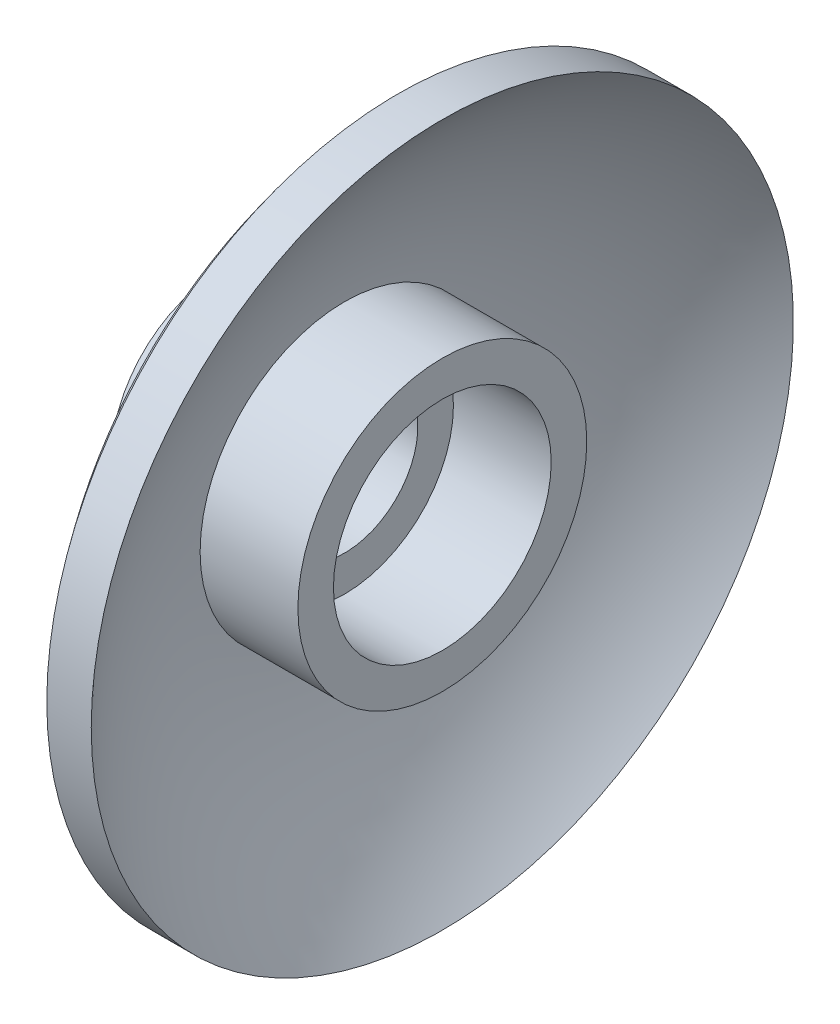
SolidWorks part; units mm, degrees
ref_plane "Vorne" through (0, 0, 0) normal (0, 0, 1) x (1, 0, 0)
ref_plane "Oben" through (0, 0, 0) normal (0, 1, 0) x (1, 0, 0)
ref_plane "Rechts" through (0, 0, 0) normal (1, 0, 0) x (0, 0, -1)
sketch "Skizze1" plane through (0, 0, 0) normal (0, 0, 1) x (1, 0, 0)
  line L0 (0, 0) -> (25.7013, 0) construction
  line L1 (17.0474, 3.25) -> (17.0474, 2.45)
  line L2 (17.0474, 3.25) -> (14.8474, 3.25)
  line L3 (12.0474, 1.65) -> (14.8474, 1.65)
  line L5 (17.0474, 7.9) -> (16.0474, 7.9)
  line L6 (13.9035, 2.45) -> (12.0474, 2.45)
  line L7 (12.0474, 2.45) -> (12.0474, 1.65)
  line L8 (17.0474, 2.45) -> (14.8474, 2.45)
  line L9 (14.8474, 2.45) -> (14.8474, 1.65)
  arc A0 (14.8474, 3.25) -> (17.0474, 7.9) centre (22.7949, 2.3353) cw
  arc A1 (13.9035, 2.45) -> (16.0474, 7.9) centre (23.3856, 1.8667) cw
  dimension "D6" = 8
  dimension "D7" = 9.5
  dimension "D1" = 15.8
  dimension "D2" = 5
  dimension "D3" = 6.5
  dimension "D4" = 4.9
  dimension "D5" = 3.3
  dimension "D8" = 2.2
  dimension "D9" = 4.9
  dimension "D10" = 1
  dimension "D11" = 2.2
  dimension "D12" = 5
revolve "Rotation1" add sketch "Skizze1" angle 360 about L0
